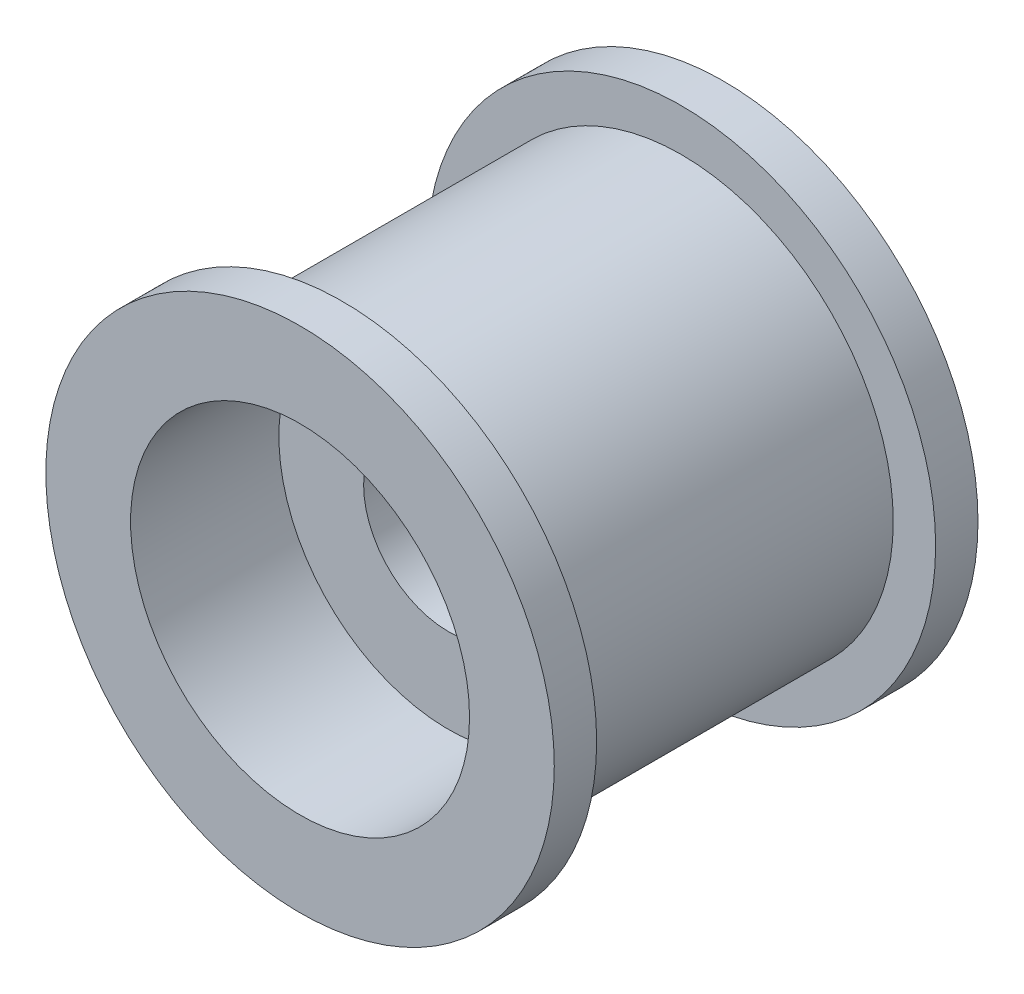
SolidWorks part; units mm, degrees
ref_plane "前视基准面" through (0, 0, 0) normal (0, 0, 1) x (1, 0, 0)
ref_plane "上视基准面" through (0, 0, 0) normal (0, 1, 0) x (1, 0, 0)
ref_plane "右视基准面" through (0, 0, 0) normal (1, 0, 0) x (0, 0, -1)
sketch "草图1" plane through (0, 0, 0) normal (0, 0, 1) x (1, 0, 0)
  circle A0 centre (0, 0) radius 6
  dimension "D1" = 12
extrude "凸台-拉伸1" add sketch "草图1" along normal blind 10
sketch "草图2" plane through (0, 0, 10) normal (0, 0, 1) x (1, 0, 0)
  circle A0 centre (0, 0) radius 6
  circle A1 centre (0, 0) radius 5
  dimension "D1" = 10
extrude "切除-拉伸1" cut sketch "草图2" against normal blind 8 from offset 1
sketch "草图3" plane through (0, 0, 10) normal (0, 0, 1) x (1, 0, 0)
  circle A0 centre (0, 0) radius 4
  dimension "D1" = 8
extrude "切除-拉伸2" cut sketch "草图3" against normal blind 3.5
ref_plane "基准面1" through (0, 0, 5) normal (0, 0, 1) x (1, 0, 0)
mirror "镜向1" about plane through (0, 0, 5) normal (0, 0, 1) of "切除-拉伸2"
sketch "草图4" plane through (0, 0, 3.5) normal (0, 0, -1) x (-1, 0, 0)
  circle A0 centre (0, 0) radius 2
  dimension "D1" = 4
extrude "切除-拉伸3" cut sketch "草图4" against normal through all
